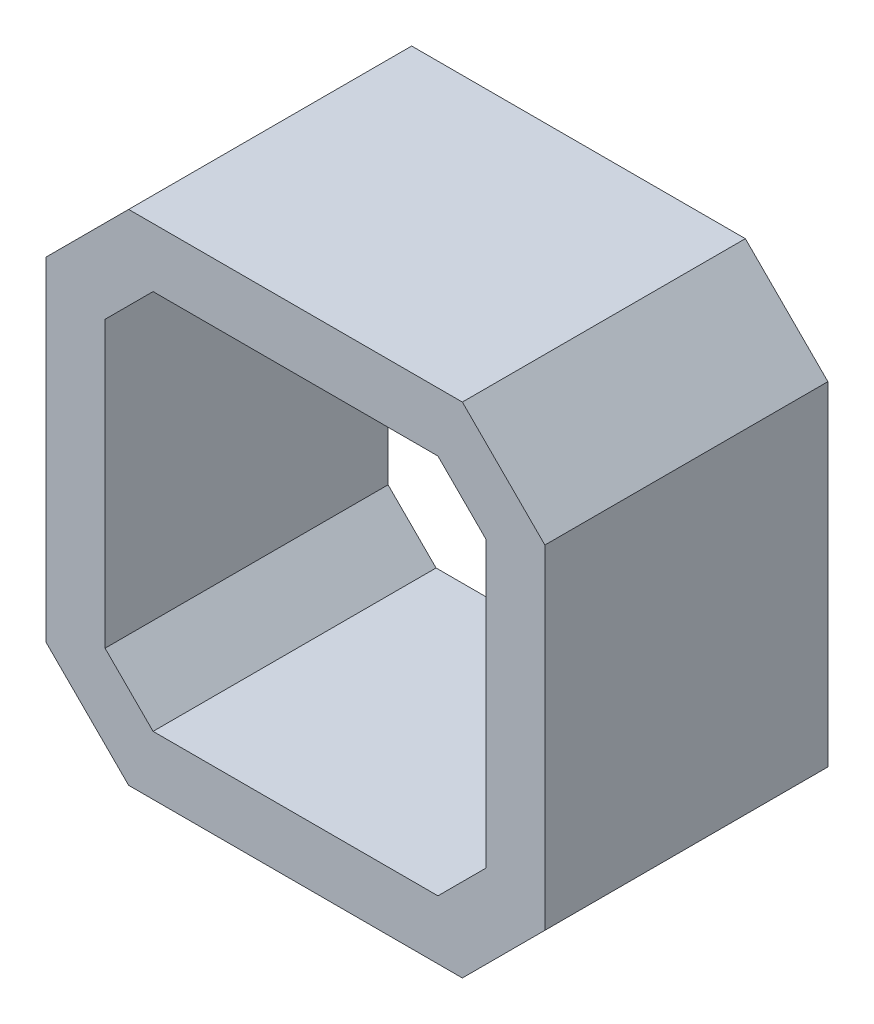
SolidWorks part; units mm, degrees
ref_plane "Front Plane" through (0, 0, 0) normal (0, 0, 1) x (1, 0, 0)
ref_plane "Top Plane" through (0, 0, 0) normal (0, 1, 0) x (1, 0, 0)
ref_plane "Right Plane" through (0, 0, 0) normal (1, 0, 0) x (0, 0, -1)
sketch "Sketch1" plane through (0, 0, 0) normal (0, 0, 1) x (1, 0, 0)
  line L0 (-14.15, 21.15) -> (-21.15, 14.15)
  line L1 (-14.15, 21.15) -> (14.15, 21.15)
  line L2 (-21.15, 14.15) -> (-21.15, -14.15)
  line L3 (-14.15, -21.15) -> (14.15, -21.15)
  line L4 (21.15, 14.15) -> (21.15, -14.15)
  line L5 (-21.15, 21.15) -> (21.15, -21.15) construction
  line L6 (-21.15, -21.15) -> (21.15, 21.15) construction
  line L7 (14.15, 21.15) -> (21.15, 14.15)
  line L8 (14.15, -21.15) -> (21.15, -14.15)
  line L9 (-21.15, -14.15) -> (-14.15, -21.15)
  line L10 (-12.0789, 16.15) -> (12.0789, 16.15)
  line L11 (12.0789, 16.15) -> (16.15, 12.0789)
  line L12 (16.15, 12.0789) -> (16.15, -12.0789)
  line L13 (12.0789, -16.15) -> (16.15, -12.0789)
  line L14 (-12.0789, -16.15) -> (12.0789, -16.15)
  line L15 (-16.15, -12.0789) -> (-12.0789, -16.15)
  line L16 (-16.15, 12.0789) -> (-16.15, -12.0789)
  line L17 (-12.0789, 16.15) -> (-16.15, 12.0789)
  point P0 (0, 0)
  dimension "D1" = 42.3
  dimension "D2" = 42.3
  dimension "D3" = 42.3
  dimension "D4" = 5
extrude "Boss-Extrude1" add sketch "Sketch1" along normal blind 24
